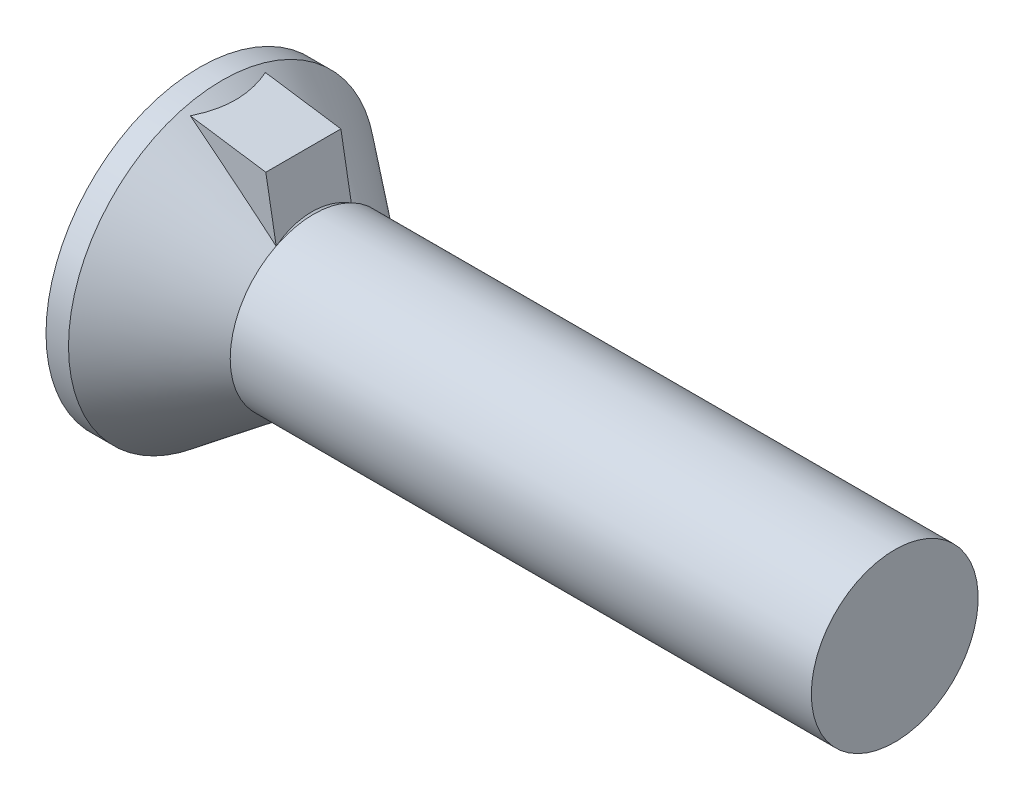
SolidWorks part; units mm, degrees
ref_plane "Front" through (0, 0, 0) normal (0, 0, 1) x (1, 0, 0)
ref_plane "Top" through (0, 0, 0) normal (0, 1, 0) x (1, 0, 0)
ref_plane "Right" through (0, 0, 0) normal (1, 0, 0) x (0, 0, -1)
sketch "Sketch1" plane through (0, 0, 0) normal (0, 0, 1) x (1, 0, 0)
  line L0 (-1.7144, 0) -> (3.448, 0) construction
  line L1 (0, 0) -> (0, 5.525)
  line L2 (0, 5.525) -> (0.8094, 5.525)
  line L3 (0.8094, 5.525) -> (4.1, 3)
  line L4 (4.1, 3) -> (25, 3)
  line L5 (25, 3) -> (25, 0)
  line L6 (0, 0) -> (25, 0)
  dimension "d" = 6
  dimension "dk" = 11.05
  dimension "D3" = 37.5
  dimension "k" = 4.1
  dimension "l" = 25
revolve "Base" add sketch "Sketch1" angle 360 about L0
sketch "Sketch15" plane through (0, 0, 0) normal (0, 0, 1) x (1, 0, 0)
  line L0 (4.1, 2.7) -> (3.7304, 4.7962)
  line L1 (4.1, 3) -> (0.8094, 5.525) construction
  line L2 (3.7304, 4.7962) -> (0.8094, 5.225)
  line L3 (0.8094, 5.525) -> (0.8094, -5.525) construction
  line L4 (-0.9577, 0) -> (4.7534, 0) construction
  line L6 (4.1, 3) -> (4.1, -3) construction
  line L9 (4.1, 2.9734) -> (4.1, 1.7155) construction
  dimension "D1" = 5.225
  dimension "D2" = 10
  dimension "D3" = 2.7
  dimension "h" = 1.2
rib "Nib" sketch "Sketch15" sketch "Sketch15" thickness 2.7 extrusion direction parallel to sketch draft on no parameters "Sn"=2.7
sketch "Sketch17" plane through (0, 0, 0) normal (0, 0, 1) x (1, 0, 0)
  line L0 (24.7293, 3.5415) -> (25.2708, 3.5415)
  line L1 (25.2708, 3.5415) -> (25.2708, 3)
  line L2 (25.2708, 3) -> (25, 2.531)
  line L3 (25, 2.531) -> (24.7293, 3)
  line L4 (24.7293, 3) -> (24.7293, 3.5415)
  line L5 (25, -3) -> (25, 3) construction
  line L7 (25, 3) -> (4.1, 3) construction
  dimension "D1" = 0.5415
revolve "Cut-Revolve10" [suppressed] cut sketch "Sketch17" angle 360 about axis through (-1.7144, 0, 0) along (1, 0, 0)
pattern_linear "LPattern10" [suppressed] count 28 along (1, 0, 0)
equation "\"D3@Sketch15\" = \"d@Sketch1\" / 2 - 0.3"
equation "\"D1@Sketch15\" = \"dk@Sketch1\" / 2 - 0.3"
equation "\"D1@Sketch17\" =  ( \"d@Sketch1\" - \"D2@ThreadCosmetic1\" )  / 2"
equation "\"pitch@LPattern10\" = 1.2 * \"D1@Sketch17\""
equation "\"D1@LPattern10\" = \"D1@ThreadCosmetic1\" / \"pitch@LPattern10\""
